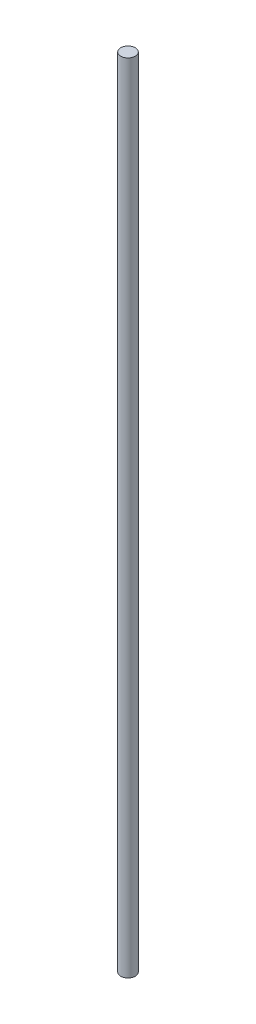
SolidWorks part; units mm, degrees
ref_plane "Plane1" through (0, 0, 0) normal (0, 0, 1) x (1, 0, 0)
ref_plane "Plane2" through (0, 0, 0) normal (0, 1, 0) x (1, 0, 0)
ref_plane "Plane3" through (0, 0, 0) normal (1, 0, 0) x (0, 0, -1)
sketch "Sketch1" plane through (0, 0, 0) normal (0, 1, 0) x (1, 0, 0)
  circle A0 centre (0, 0) radius 1.397
  dimension "D1" = 2.794
extrude "Base-Extrude" add sketch "Sketch1" along normal mid plane 152.4
